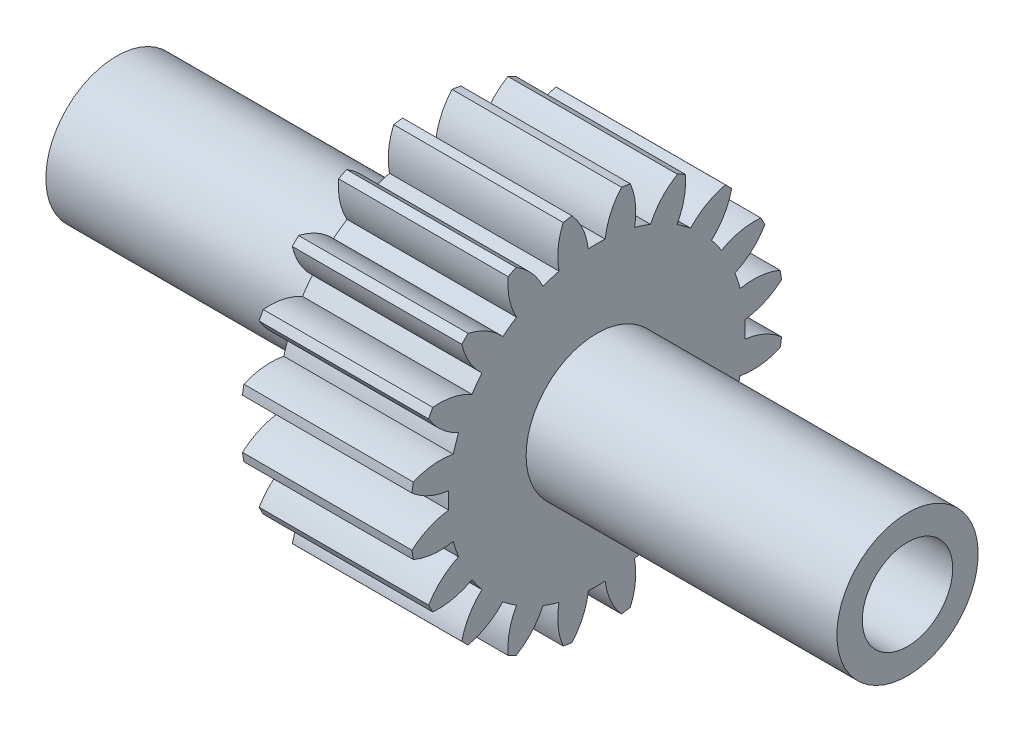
SolidWorks part; units mm, degrees
ref_plane "Plane1" through (0, 0, 0) normal (0, 0, 1) x (1, 0, 0)
ref_plane "Plane2" through (0, 0, 0) normal (0, 1, 0) x (1, 0, 0)
ref_plane "Plane3" through (0, 0, 0) normal (1, 0, 0) x (0, 0, -1)
other "Configuration Table"
sketch "HoldingSke" plane through (0, 0, 0) normal (0, 1, 0) x (1, 0, 0)
  line L0 (0, 0) -> (0.6265, -0.228)
  line L1 (-15, 0) -> (100, 0) construction
  line L2 (0, 0) -> (-2.1039, 2.3779)
  line L3 (0, 0) -> (-11.863, 4.5341)
  line L4 (0, 0) -> (8.1152, 2.9537)
  line L5 (0, 0) -> (-65.5867, -24.4619)
  line L6 (0, 0) -> (-12.4344, -8.3896)
  line L7 (-2.1039, 2.3779) -> (12.9636, 70.7371)
  line L8 (-76.2, 54.61) -> (-74.8, 54.61)
  line L9 (-71.009, 38.7566) -> (-53.1078, 45.2721)
  line L10 (-76.2, 71.12) -> (104.1128, 71.12)
  line L11 (0, 0) -> (-15, 0)
  line L12 (-76.2, 101.6) -> (-76.147, 101.6)
  line L13 (24.9733, 27.94) -> (52.9518, 28.4284)
  line L14 (24.9733, 27.94) -> (24.9743, 27.94)
  line L15 (24.9733, 27.94) -> (100.4006, 29.5858)
  line L16 (-63.627, -1.5) -> (-12.827, -1.5)
  circle A0 centre (0, 0) radius 4
  circle A1 centre (0, 0) radius 6.25
  circle A2 centre (0, 0) radius 6.25
  circle A3 centre (0, 0) radius 4
sketch "BasProSke" plane through (0, 0, 0) normal (0, 1, 0) x (1, 0, 0)
  line L0 (-10, 0) -> (60, 0) construction
  line L1 (0, 0) -> (0, 16.5)
  line L2 (0, 0) -> (15, 0)
  line L3 (15, 0) -> (15, 16.5)
  line L4 (15, 16.5) -> (0, 16.5)
revolve "Base-Revolve" add sketch "BasProSke" angle 360 about L0
sketch "TooCutSke" plane through (0, 0, 0) normal (1, 0, 0) x (0, 0, -1)
  line L1 (0, 0) -> (0, 107) construction
  line L2 (0, 0) -> (-1.2696, 14.9462) construction
  line L3 (0, 0) -> (-4.6808, 29.5532) construction
  line L4 (-1.2696, 14.9462) -> (-2.3404, 14.7766) construction
  arc A0 (0.7438, 13.1029) -> (-0.7438, 13.1029) centre (0, 0) ccw
  arc A1 (2.21, 16.377) -> (-2.21, 16.377) centre (0, 0) ccw
  circle A2 centre (0, 0) radius 15 construction
  circle A3 centre (0, 0) radius 14.0954 construction
  arc A4 (-0.7438, 13.1029) -> (-2.21, 16.377) centre (-6.7025, 12.3999) ccw
  arc A5 (2.21, 16.377) -> (0.7438, 13.1029) centre (6.7025, 12.3999) ccw
extrude "ToothCut" cut sketch "TooCutSke" along normal through all
fillet "Breaks" [suppressed] radius 0.03
fillet "RootFillets" [suppressed] radius 0.376
pattern_circular "TeethCuts" count 20 every 18 about axis through (-10, 0, 0) along (1, 0, 0) of "ToothCut", "RootFillets", "Breaks"
sketch "HubNeaOneSke" plane through (0, 0, 0) normal (-1, 0, 0) x (0, 0, 1)
  circle A0 centre (0, 0) radius 6.25
extrude "HubNearOne" [suppressed] add sketch "HubNeaOneSke" along normal blind 55.0001
sketch "HubNeaBotSke" plane through (0, 0, 0) normal (-1, 0, 0) x (0, 0, 1)
  circle A0 centre (0, 0) radius 6.25
extrude "HubNearBoth" add sketch "HubNeaBotSke" along normal blind 27.5
ref_plane "FarPln" through (15, 0, 0) normal (1, 0, 0) x (0, 0, -1)
sketch "HubFarSke" plane through (15, 0, 0) normal (1, 0, 0) x (0, 0, -1)
  circle A0 centre (0, 0) radius 6.25
extrude "HubFar" add sketch "HubFarSke" along normal blind 27.5
sketch "BorSke" plane through (0, 0, 0) normal (1, 0, 0) x (0, 0, -1)
  circle A0 centre (0, 0) radius 4
extrude "Bore" cut sketch "BorSke" along normal mid plane 140.0001
sketch "KeySke" plane through (0, 0, 0) normal (1, 0, 0) x (0, 0, -1)
  line L0 (-1.5, 0) -> (-1.5, 5.4)
  line L1 (-1.5, 5.4) -> (1.5, 5.4)
  line L2 (1.5, 5.4) -> (1.5, 0)
  line L3 (0, 0) -> (0, 34) construction
  line L4 (-1.5, 0) -> (1.5, 0)
extrude "Keyway" [suppressed] cut sketch "KeySke" along normal mid plane 140.0001
pattern_circular "Keyway2" [suppressed] count 2 every 90 about axis through (-10, 0, 0) along (1, 0, 0)
equation "' \"Module@HoldingSke\" = 6.35"
equation "' \"Num_teeth@HoldingSke\" = 12"
equation "' \"Ap@HoldingSke\" =  20"
equation "' \"Ap@HoldingSke\" = 20"
equation "' \"Width@HoldingSke\" = 0.5 * 25.4"
equation "' \"Hub_dia@HoldingSke\"= 1 * 25.4"
equation "' \"Hub_dia@HoldingSke\" = 1 * 25.4"
equation "' \"Overall_len@HoldingSke\" = 1.0 * 25.4"
equation "' \"Bore@HoldingSke\" = 0.75 * 25.4"
equation "' \"T_dim@HoldingSke\" = 0.1 * 25.4"
equation "' \"Width@KeySke\" = 0.25 * 25.4"
equation "' \"Show_teeth@HoldingSke\" = 13"
equation "' \"Backlash@HoldingSke\" = 0.009 * 25.4"
equation "' \"Addendum_fac@HoldingSke\" = 1.0"
equation "' \"Dedendum_fac@HoldingSke\" = 1.25"
equation "' \"Dedendum_add@HoldingSke\" = 0.00005 * 25.4"
equation "' \"Clearance_fac@HoldingSke\" = 0.25"
equation "\"Pitch@HoldingSke\" = 1 / \"Module@HoldingSke\""
equation "\"Overcut_dia@TooCutSke\" = (\"Num_teeth@HoldingSke\" + 2 * \"Addendum_fac@HoldingSke\") / \"Pitch@HoldingSke\" + 0.002 * 25.4"
equation "\"Pitch_dia@TooCutSke\" = \"Num_teeth@HoldingSke\" / \"Pitch@HoldingSke\""
equation "\"Base_dia@TooCutSke\" = \"Num_teeth@HoldingSke\" / \"Pitch@HoldingSke\" * cos((\"Ap@HoldingSke\"  * 3.14159265 / 180))"
equation "\"Root_dia@TooCutSke\" = (\"Num_teeth@HoldingSke\" + 2) / \"Pitch@HoldingSke\" - 2 * (\"Addendum_fac@HoldingSke\" + \"Dedendum_fac@HoldingSke\") / \"Pitch@HoldingSke\" - \"Dedendum_add@HoldingSke\" * 2"
equation "\"Half_ang@TooCutSke\" = 180 / \"Num_teeth@HoldingSke\""
equation "\"Half_CT@TooCutSke\" = \"Num_teeth@HoldingSke\" / \"Pitch@HoldingSke\" * sin((3.14159265 / 2 / \"Num_teeth@HoldingSke\")) / 2 - 7 * \"Backlash@HoldingSke\" / 4"
equation "\"Flank_rad@TooCutSke\" = \"Num_teeth@HoldingSke\" / \"Pitch@HoldingSke\" / 5"
equation "\"Radius@RootFillets\" = \"Clearance_fac@HoldingSke\" / \"Pitch@HoldingSke\" + \"Dedendum_add@HoldingSke\""
equation "\"Break_rad@Breaks\" = 0.02 / \"Pitch@HoldingSke\""
equation "\"Thickness@HoldingSke\" = \"Width@HoldingSke\""
equation "\"OAL@HoldingSke\" = \"Thickness@HoldingSke\""
equation "\"MHD@HoldingSke\" = (\"Num_teeth@HoldingSke\" + 2) / \"Pitch@HoldingSke\" - 2 * (\"Addendum_fac@HoldingSke\" + \"Dedendum_fac@HoldingSke\")  / \"Pitch@HoldingSke\" - \"Dedendum_add@HoldingSke\" * 2"
equation "\"MBD@HoldingSke\" = (\"Num_teeth@HoldingSke\" + 2) / \"Pitch@HoldingSke\" - 2 * (\"Addendum_fac@HoldingSke\" + \"Dedendum_fac@HoldingSke\")  / \"Pitch@HoldingSke\" - \"Dedendum_add@HoldingSke\" * 2 - 0.002 * 25.4"
equation "\"MHD@HoldingSke\" = ((sgn( \"MHD@HoldingSke\" - \"Hub_dia@HoldingSke\" )-1)*( \"MHD@HoldingSke\" - \"Hub_dia@HoldingSke\" ))/-2+ \"Hub_dia@HoldingSke\""
equation "\"MBD@HoldingSke\" = ((sgn( \"MBD@HoldingSke\" - \"Bore@HoldingSke\" )-1)*( \"MBD@HoldingSke\" - \"Bore@HoldingSke\" ))/-2+ \"Bore@HoldingSke\""
equation "\"OAL@HoldingSke\" = ((sgn( \"OAL@HoldingSke\" - \"Overall_len@HoldingSke\" )+1)*( \"OAL@HoldingSke\" - \"Overall_len@HoldingSke\" ))/2 + \"Overall_len@HoldingSke\" + 0.000002 * 25.4"
equation "\"Num_teeth@TeethCuts\" = int( \"Show_teeth@HoldingSke\" ) + 1"
equation "\"Num_teeth@TeethCuts\" = ((sgn( \"Num_teeth@TeethCuts\" - \"Num_teeth@HoldingSke\" )-1)*( \"Num_teeth@TeethCuts\" - \"Num_teeth@HoldingSke\" ))/-2+ \"Num_teeth@HoldingSke\""
equation "\"Num_teeth@TeethCuts\" = ((sgn( \"Num_teeth@TeethCuts\" - 2.0)+1)*( \"Num_teeth@TeethCuts\" - 2.0))/2 +2.0"
equation "\"Angle@TeethCuts\" = 360.0 / \"Num_teeth@HoldingSke\""
equation "\"Diameter@BasProSke\" = (\"Num_teeth@HoldingSke\" + 2 * \"Addendum_fac@HoldingSke\") / \"Pitch@HoldingSke\""
equation "\"Thickness@BasProSke\"  = \"Thickness@HoldingSke\""
equation "' \"Fillet_rad@BasProSke\" =  \"Thickness@HoldingSke\" * 0.05"
equation "' \"Fillet_rad@BasProSke\" = \"Thickness@HoldingSke\" * 0.05"
equation "\"MHD@HoldingSke\" = ((sgn( \"MHD@HoldingSke\" - \"Root_dia@TooCutSke\" )-1)*( \"MHD@HoldingSke\" - \"Root_dia@TooCutSke\" ))/-2+ \"Root_dia@TooCutSke\""
equation "\"Diameter@HubNeaOneSke\" = \"MHD@HoldingSke\""
equation "\"Length@HubNearOne\" = \"OAL@HoldingSke\" - \"Thickness@BasProSke\""
equation "\"Diameter@HubNeaBotSke\" = \"MHD@HoldingSke\""
equation "\"Length@HubNearBoth\" = ( \"OAL@HoldingSke\" - \"Thickness@BasProSke\" ) / 2.0"
equation "\"Thickness@FarPln\" = \"Thickness@BasProSke\""
equation "\"Diameter@HubFarSke\" = \"MHD@HoldingSke\""
equation "\"Length@HubFar\" = ( \"OAL@HoldingSke\" - \"Thickness@BasProSke\" ) / 2.0"
equation "\"Diameter@BorSke\" = \"MBD@HoldingSke\""
equation "\"D1@Bore\" = \"OAL@HoldingSke\" * 2.0"
equation "\"D1@Keyway\" = \"OAL@HoldingSke\" * 2.0"
equation "\"Offset@KeySke\" = \"T_dim@HoldingSke\" + \"MBD@HoldingSke\" / 2.0"
